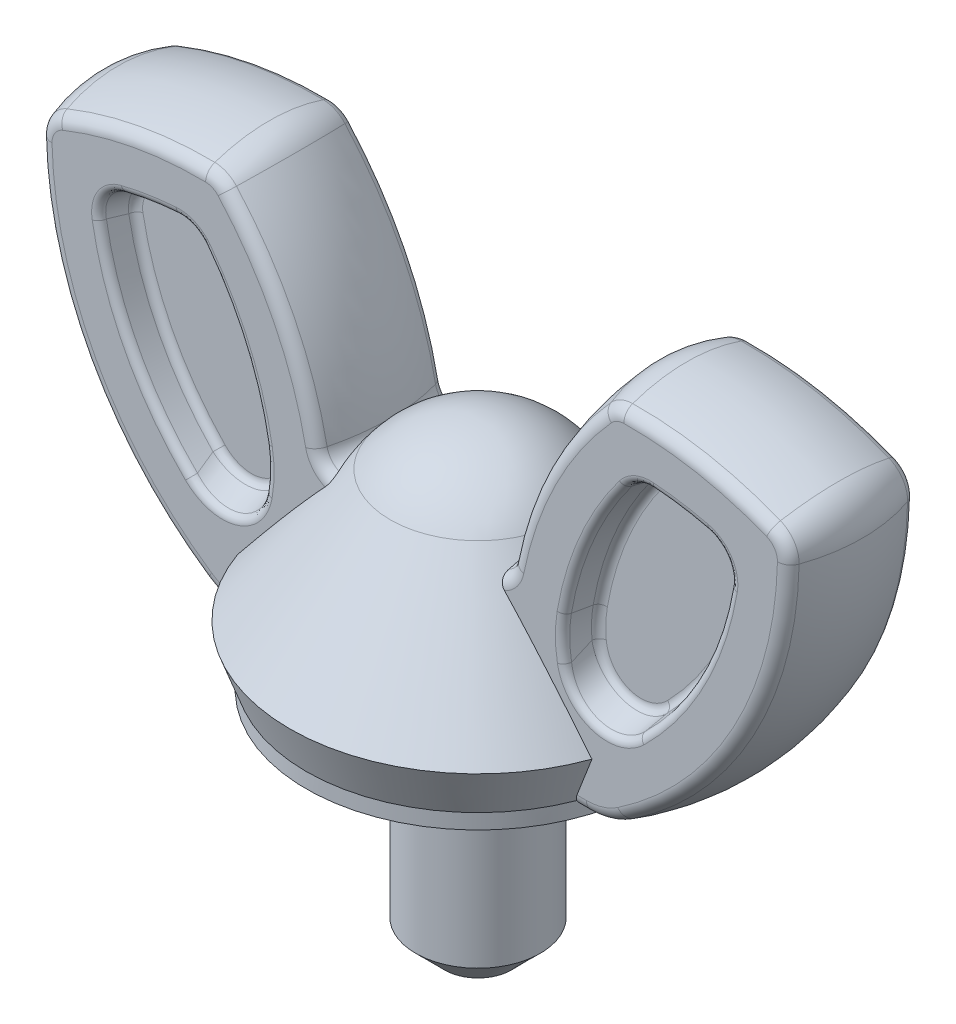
SolidWorks part; units mm, degrees
ref_plane "Front Plane" through (0, 0, 0) normal (0, 0, 1) x (1, 0, 0)
ref_plane "Top Plane" through (0, 0, 0) normal (0, 1, 0) x (1, 0, 0)
ref_plane "Right Plane" through (0, 0, 0) normal (1, 0, 0) x (0, 0, -1)
sketch "Sketch1" plane through (0, 0, 0) normal (0, 0, 1) x (1, 0, 0)
  line L0 (0, 10.7344) -> (0, 0) construction
  line L5 (4.826, 0) -> (-4.826, 0)
  line L6 (2.413, 5.08) -> (-2.413, 5.08)
  arc A11 (-2.413, 5.08) -> (-5.3975, 10.9034) centre (-13.1787, 3.2391) ccw
  arc A13 (-5.3975, 10.9034) -> (-10.795, 9.8298) centre (-6.0342, 0) ccw
  arc A24 (-10.795, 9.8298) -> (-6.0486, 0.3742) centre (0, 9.3295) ccw
  arc A26 (-4.826, 0) -> (-6.0486, 0.3742) centre (-4.826, 2.1844) cw
  arc A29 (4.826, 0) -> (6.0486, 0.3742) centre (4.826, 2.1844) ccw
  arc A34 (10.795, 9.8298) -> (6.0486, 0.3742) centre (0, 9.3295) cw
  arc A36 (5.3975, 10.9034) -> (10.795, 9.8298) centre (6.0342, 0) cw
  arc A37 (2.413, 5.08) -> (5.3975, 10.9034) centre (13.1787, 3.2391) cw
  point P19 (0, 0)
  point P27 (0, 5.08)
  point P29 (0, 5.08)
  point P44 (0, 5.08)
  dimension "D2" = 2.1844
  dimension "D1" = 5.3975
  dimension "D3" = 9.8298
  dimension "D4" = 10.922
  dimension "B" = 10.922
  dimension "A" = 21.59
  dimension "E" = 9.652
  dimension "G" = 5.08
  dimension "D5" = 4.826
extrude "Extrude1" add sketch "Sketch1" along normal mid plane 3.556
fillet "Fillet4" radius 1.0922 4 edges at (10.795, 9.8298, 0) (5.3975, 10.9034, 0) (-5.3975, 10.9034, 0) (-10.795, 9.8298, 0)
sketch "Sketch2" plane through (0, 0, 1.778) normal (0, 0, 1) x (1, 0, 0)
  line L0 (0, 0) -> (0, 12.8329) construction
  line L1 (-4.826, 0) -> (4.826, 0) construction
  arc A10 (-4.1864, 4.7767) -> (-5.0416, 1.8652) centre (-7.5893, 4.1949) cw
  arc A11 (4.1864, 4.7767) -> (6.2055, 9.1212) centre (13.1787, 3.2391) cw
  arc A12 (6.2055, 9.1212) -> (8.9805, 8.634) centre (6.0342, 0) cw
  arc A13 (8.9805, 8.634) -> (5.0416, 1.8652) centre (0, 9.3295) cw
  arc A14 (4.1864, 4.7767) -> (5.0416, 1.8652) centre (7.5893, 4.1949) ccw
  arc A15 (-8.9805, 8.634) -> (-5.0416, 1.8652) centre (0, 9.3295) ccw
  arc A16 (-6.2055, 9.1212) -> (-8.9805, 8.634) centre (-6.0342, 0) ccw
  arc A17 (-4.1864, 4.7767) -> (-6.2055, 9.1212) centre (-13.1787, 3.2391) ccw
  arc A18 (-8.9805, 8.634) -> (-5.0416, 1.8652) centre (0, 9.3295) ccw
  arc A19 (-6.2055, 9.1212) -> (-8.9805, 8.634) centre (-6.0342, 0) ccw
  arc A20 (-4.1864, 4.7767) -> (-6.2055, 9.1212) centre (-13.1787, 3.2391) ccw
  dimension "D1" = 1.7992
extrude "Cut-Extrude1" cut sketch "Sketch2" against normal blind 0.889 draft 10
fillet "Fillet1" radius 0.889 4 edges
fillet "Fillet6" radius 1.2446 2 edges
fillet "Fillet5" radius 0.3641 2 edges at (2.413, 5.08, 0) (-2.413, 5.08, 0)
fillet "Fillet3" radius 0.2223 28 edges at (7.4585, 9.011, 1.778) (7.4007, 8.8613, 0.889) (6.4621, 8.9114, 0.889) (8.6146, 8.3041, 0.889) (7.8855, 5.3103, 0.889) (4.2988, 4.3764, 0.889) (6.1282, 8.9579, 1.778) (8.7221, 8.5339, 1.778) (7.9776, 5.1471, 1.778) (4.1377, 4.1292, 1.778) (-4.2988, 4.3764, 0.889) (-7.8855, 5.3103, 0.889) (-8.5332, 8.4279, 0.889) (-7.4007, 8.8613, 0.889) (-6.1942, 8.7899, 0.889) (-4.1377, 4.1292, 1.778) (-7.9776, 5.1471, 1.778) (-8.7866, 8.4358, 1.778) (-7.4585, 9.011, 1.778) (-6.3795, 9.0717, 1.778) (4.9351, 6.7652, 0.889) (4.81, 6.8709, 1.778) (-4.9351, 6.7652, 0.889) (-4.81, 6.8709, 1.778) (4.9742, 2.938, 0.889) (5.0791, 2.5366, 1.778) (-5.2102, 2.8514, 0.889) (-5.0131, 2.5568, 1.778)
mirror "Mirror1" about plane through (0, 0, 0) normal (0, 0, 1) of "Fillet6", "Fillet3", "Fillet1", "Cut-Extrude1"
sketch "Sketch4" plane through (0, 0, 0) normal (1, 0, 0) x (0, 0, -1)
  line L1 (-1.778, 5.334) -> (1.778, 5.334)
  line L2 (-1.778, 4.4704) -> (-1.778, 5.334)
  line L4 (1.778, 0.3742) -> (1.778, 9.0918) construction
  line L6 (-1.778, 9.0918) -> (-1.778, 0.3742) construction
  line L7 (0, 5.715) -> (0, 0.381) construction
  line L9 (1.778, 4.4704) -> (1.778, 5.334)
  line L10 (-1.778, 5.08) -> (1.778, 5.08) construction
  arc A0 (-1.524, 4.826) -> (-1.778, 4.4704) centre (-1.4021, 4.4704) ccw
  arc A1 (1.524, 4.826) -> (-1.524, 4.826) centre (0, 0.381) ccw
  arc A2 (1.524, 4.826) -> (1.778, 4.4704) centre (1.4021, 4.4704) cw
  point P8 (0, 5.08)
  dimension "D1" = 0.254
  dimension "D2" = 0.254
  dimension "D3" = 0.254
sketch3d "3DSketch1"
  line L2 (-2.1102, 5.08, 1.778) -> (2.1102, 5.08, 1.778)
  line L3 (4.826, 0, 1.778) -> (-4.826, 0, 1.778)
  line L4 (-2.1102, 5.08, 1.778) -> (2.1102, 5.08, 1.778)
  line L5 (4.826, 0, 1.778) -> (-4.826, 0, 1.778)
  arc A15 (10.804, 9.0918, 1.778) -> (6.0486, 0.3742, 1.778) centre (0, 9.3295, 1.778) ccw
  arc A16 (10.1207, 10.1287, 1.778) -> (10.804, 9.0918, 1.778) centre (9.712, 9.1158, 1.778) ccw
  arc A17 (5.8682, 10.9207, 1.778) -> (10.1207, 10.1287, 1.778) centre (6.0342, 0, 1.778) ccw
  arc A18 (5.0743, 10.5608, 1.778) -> (5.8682, 10.9207, 1.778) centre (5.8848, 9.8287, 1.778) ccw
  arc A19 (2.4672, 5.3729, 1.778) -> (5.0743, 10.5608, 1.778) centre (13.1787, 3.2391, 1.778) ccw
  arc A20 (2.1102, 5.08, 1.778) -> (2.4672, 5.3729, 1.778) centre (2.1102, 5.4441, 1.778) ccw
  arc A21 (2.1102, 5.08, 1.778) -> (2.4672, 5.3729, 1.778) centre (2.1102, 5.4441, 1.778) ccw
  arc A22 (-5.0743, 10.5608, 1.778) -> (-2.4672, 5.3729, 1.778) centre (-13.1787, 3.2391, 1.778) ccw
  arc A23 (-5.8682, 10.9207, 1.778) -> (-5.0743, 10.5608, 1.778) centre (-5.8848, 9.8287, 1.778) ccw
  arc A24 (-10.1207, 10.1287, 1.778) -> (-5.8682, 10.9207, 1.778) centre (-6.0342, 0, 1.778) ccw
  arc A25 (-10.804, 9.0918, 1.778) -> (-10.1207, 10.1287, 1.778) centre (-9.712, 9.1158, 1.778) ccw
  arc A26 (-6.0486, 0.3742, 1.778) -> (-10.804, 9.0918, 1.778) centre (0, 9.3295, 1.778) ccw
  arc A27 (-4.826, 0, 1.778) -> (-6.0486, 0.3742, 1.778) centre (-4.826, 2.1844, 1.778) ccw
  arc A28 (6.0486, 0.3742, 1.778) -> (4.826, 0, 1.778) centre (4.826, 2.1844, 1.778) ccw
  arc A29 (10.804, 9.0918, 1.778) -> (6.0486, 0.3742, 1.778) centre (0, 9.3295, 1.778) ccw
  arc A30 (10.1207, 10.1287, 1.778) -> (10.804, 9.0918, 1.778) centre (9.712, 9.1158, 1.778) ccw
  arc A31 (5.8682, 10.9207, 1.778) -> (10.1207, 10.1287, 1.778) centre (6.0342, 0, 1.778) ccw
  arc A32 (5.0743, 10.5608, 1.778) -> (5.8682, 10.9207, 1.778) centre (5.8848, 9.8287, 1.778) ccw
  arc A33 (2.4672, 5.3729, 1.778) -> (5.0743, 10.5608, 1.778) centre (13.1787, 3.2391, 1.778) ccw
  arc A34 (-2.4672, 5.3729, 1.778) -> (-2.1102, 5.08, 1.778) centre (-2.1102, 5.4441, 1.778) ccw
  arc A35 (-2.4672, 5.3729, 1.778) -> (-2.1102, 5.08, 1.778) centre (-2.1102, 5.4441, 1.778) ccw
  arc A36 (-5.0743, 10.5608, 1.778) -> (-2.4672, 5.3729, 1.778) centre (-13.1787, 3.2391, 1.778) ccw
  arc A37 (-5.8682, 10.9207, 1.778) -> (-5.0743, 10.5608, 1.778) centre (-5.8848, 9.8287, 1.778) ccw
  arc A38 (-10.1207, 10.1287, 1.778) -> (-5.8682, 10.9207, 1.778) centre (-6.0342, 0, 1.778) ccw
  arc A39 (-10.804, 9.0918, 1.778) -> (-10.1207, 10.1287, 1.778) centre (-9.712, 9.1158, 1.778) ccw
  arc A40 (-6.0486, 0.3742, 1.778) -> (-10.804, 9.0918, 1.778) centre (0, 9.3295, 1.778) ccw
  arc A41 (-4.826, 0, 1.778) -> (-6.0486, 0.3742, 1.778) centre (-4.826, 2.1844, 1.778) ccw
  arc A42 (6.0486, 0.3742, 1.778) -> (4.826, 0, 1.778) centre (4.826, 2.1844, 1.778) ccw
  point P3 (2.1102, 5.4441, 2.1421)
  point P5 (2.1102, 5.4441, 2.1421)
  point P11 (-2.1102, 5.4441, 2.1421)
  point P13 (-2.1102, 5.4441, 2.1421)
  point P43 (0, 9.3295, -9.0286)
  point P46 (9.712, 9.1158, 0.6858)
  point P48 (6.0342, 0, -9.144)
  point P50 (5.8848, 9.8287, 0.6858)
  point P52 (13.1787, 3.2391, -9.144)
  point P58 (-13.1787, 3.2391, -9.144)
  point P60 (-5.8848, 9.8287, 0.6858)
  point P62 (-6.0342, 0, -9.144)
  point P64 (-9.712, 9.1158, 0.6858)
  point P66 (0, 9.3295, -9.0286)
  point P68 (-4.826, 2.1844, -0.4064)
  point P70 (4.826, 2.1844, -0.4064)
  point P71 (0, 9.3295, -9.0286)
  point P72 (9.712, 9.1158, 0.6858)
  point P73 (6.0342, 0, -9.144)
  point P74 (5.8848, 9.8287, 0.6858)
  point P75 (13.1787, 3.2391, -9.144)
  point P78 (-13.1787, 3.2391, -9.144)
  point P79 (-5.8848, 9.8287, 0.6858)
  point P80 (-6.0342, 0, -9.144)
  point P81 (-9.712, 9.1158, 0.6858)
  point P82 (0, 9.3295, -9.0286)
  point P83 (-4.826, 2.1844, -0.4064)
  point P84 (4.826, 2.1844, -0.4064)
  dimension "D1" = 0
sweep "Cut-Sweep2" cut profiles "Sketch4" path "3DSketch1"
sketch "Sketch3" plane through (0, 0, 0) normal (0, 0, 1) x (1, 0, 0)
  line L0 (0, 6.5903) -> (0, -11.3525) construction
  line L1 (1.7526, 0) -> (4.826, 0)
  line L2 (5.2882, 1.6933) -> (2.4672, 5.3729)
  line L4 (1.7526, 0) -> (1.7526, -6.35)
  line L5 (1.7526, -6.35) -> (0, -6.35)
  line L6 (4.826, 0) -> (4.826, 0.4233)
  line L7 (0, 6.5903) -> (0, -6.35)
  line L8 (0, 6.5903) -> (-2.4754, 6.5903) construction
  line L9 (4.826, 0.4233) -> (5.2882, 1.6933)
  arc A1 (2.4672, 5.3729) -> (0, 6.5903) centre (0, 3.4814) ccw
  dimension "D2" = 1.27
  dimension "D3" = 9.652
  dimension "d1" = 3.5052
  dimension "D4" = 0.4233
  dimension "L" = 6.35
  dimension "D5" = 20
revolve "Revolve1" add sketch "Sketch3" angle 360 about L0
sketch "Sketch6" plane through (0, 0, 0) normal (0, 0, 1) x (1, 0, 0)
  line L0 (0, 4.5862) -> (0, -4.5862) construction
  line L1 (0.9398, -6.35) -> (0, -5.7853)
  line L2 (0, -5.7853) -> (0, -6.604)
  line L3 (0, -6.604) -> (1.778, -6.604)
  line L4 (1.778, -6.604) -> (1.778, -5.5118)
  line L5 (1.778, -5.5118) -> (0.9398, -6.35)
  line L6 (-1.7526, -6.35) -> (1.7526, -6.35) construction
  line L7 (1.7526, -6.35) -> (1.7526, 0) construction
  dimension "D1" = 45
  dimension "D2" = 59
  dimension "D3" = 0.254
  dimension "O" = 1.8796
  dimension "D5" = 0.0254
revolve "Cut-Revolve11" cut sketch "Sketch6" angle 360 about L0
sketch "Sketch5" plane through (0, 0, 0) normal (0, 0, 1) x (1, 0, 0)
  line L0 (1.7526, -0.0254) -> (1.2802, -0.2982)
  line L1 (1.2802, -0.2982) -> (1.7526, -0.5709)
  line L2 (1.7526, -0.5709) -> (1.7526, -0.0254)
  line L3 (0, 0) -> (0, -7.7715) construction
  line L6 (1.2802, -0.2982) -> (1.2802, -1.0906) construction
  dimension "D1" = 3.5052
  dimension "D2" = 2.5603
  dimension "D3" = 0.0254
  dimension "pitch" = 0.7925
revolve "Cut-Revolve10" [suppressed] cut sketch "Sketch5" angle 360 about L3
pattern_linear "LPattern10" [suppressed] count 8 spacing 0.7925 along (0, -1, 0)
equation "\"D5@Sketch1\" = \"E@Sketch1\" / 2"
equation "\"D1@Sketch1\" = \"A@Sketch1\" / 4"
equation "\"D3@Sketch1\" = \"B@Sketch1\" * 9 /  10"
equation "\"D4@Sketch1\" = \"B@Sketch1\""
equation "\"D2@Sketch1\" = \"D4@Sketch1\" / 5"
equation "\"D1@Cut-Extrude1\" = \"C@Extrude1\" / 4"
equation "\"D1@Fillet1\" = \"D1@Cut-Extrude1\""
equation "\"D1@Fillet3\" = \"D1@Cut-Extrude1\" / 4"
equation "\"D2@Sketch3\" = \"G@Sketch1\" / 4"
equation "\"D3@Sketch3\" = \"E@Sketch1\""
equation "\"D1@Sketch4\" = \"C@Extrude1\" / 14"
equation "\"D1@Sketch5\" = \"d1@Sketch3\""
equation "\"D2@Sketch5\" = \"THD_MINOR@Cosmetic Thread1\""
equation "\"D3@LPattern10\" = \"pitch@Sketch5\""
equation "\"D1@LPattern10\" = \"L@Sketch3\" / \"D3@LPattern10\""
equation "\"D1@Cosmetic Thread1\" = \"L@Sketch3\""
equation "\"D2@Sketch4\" = \"D1@Sketch4\""
equation "\"D4@Sketch3\" = \"D2@Sketch3\" / 3"
equation "\"D1@Fillet4\" = \"D2@Sketch1\" /2"
equation "\"D1@Sketch2\" = \"D1@Sketch1\" / 3"
equation "\"D1@Fillet5\" = \"D1@Fillet4\" / 3"
equation "\"D1@Fillet6\" = \"D1@Fillet1\" * 1.4"
